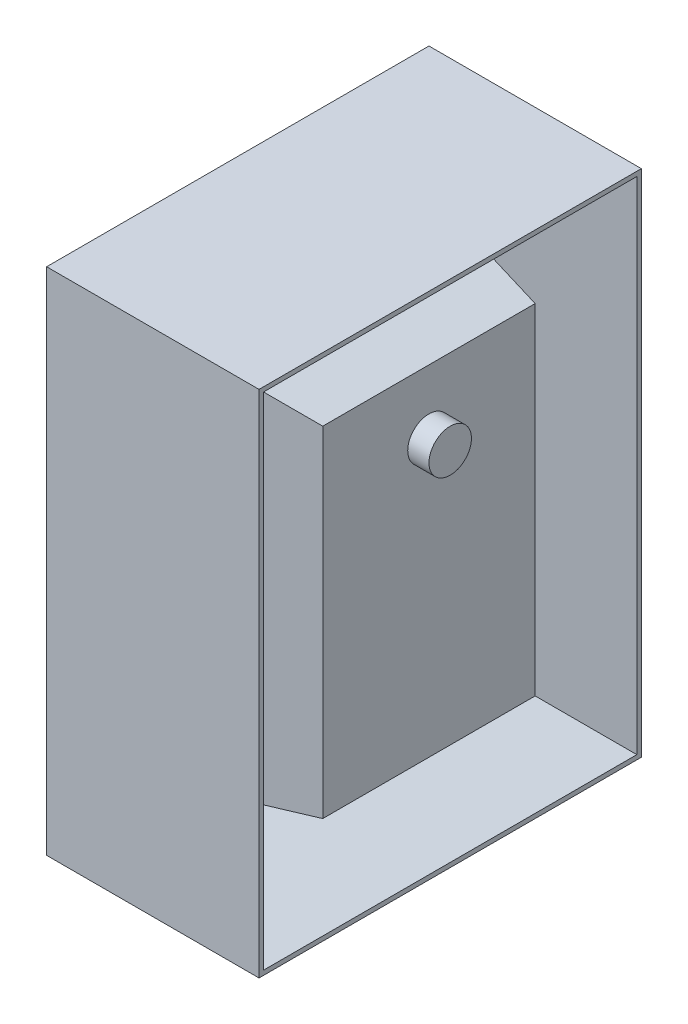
SolidWorks part; units mm, degrees
ref_plane "Plan de face" through (0, 0, 0) normal (0, 0, 1) x (1, 0, 0)
ref_plane "Plan de dessus" through (0, 0, 0) normal (0, 1, 0) x (1, 0, 0)
ref_plane "Plan de droite" through (0, 0, 0) normal (1, 0, 0) x (0, 0, -1)
sketch "Esquisse1" plane through (0, 0, 0) normal (1, 0, 0) x (0, 0, -1)
  line L1 (0, 0) -> (-90, 0)
  line L2 (0, 0) -> (0, 120)
  line L3 (0, 120) -> (-90, 120)
  line L4 (-90, 0) -> (-90, 120)
  dimension "D1" = 120
  dimension "D2" = 90
extrude "Boss.-Extru.1" add sketch "Esquisse1" along normal blind 5
sketch "Esquisse2" plane through (5, 0, 0) normal (1, 0, 0) x (0, 0, -1)
  line L1 (-90, 120) -> (0, 120)
  line L2 (-90, 120) -> (-90, 0)
  line L3 (-90, 0) -> (0, 0)
  line L4 (0, 120) -> (0, 0)
  line L5 (-81, 111) -> (-9, 111)
  line L6 (-81, 111) -> (-81, 9)
  line L7 (-81, 9) -> (-9, 9)
  line L8 (-9, 111) -> (-9, 9)
  dimension "D1" = 9
  dimension "D2" = 9
  dimension "D3" = 9
  dimension "D4" = 9
extrude "Boss.-Extru.2" add sketch "Esquisse2" along normal blind 45
sketch "Esquisse3" plane through (5, 0, 0) normal (1, 0, 0) x (0, 0, -1)
  line L0 (-81, 111) -> (-9, 9) construction
  line L2 (-70, 20) -> (-20, 20)
  line L3 (-70, 20) -> (-70, 100)
  line L4 (-70, 100) -> (-20, 100)
  line L5 (-20, 20) -> (-20, 100)
  line L6 (-70, 20) -> (-20, 100) construction
  line L7 (-70, 100) -> (-20, 20) construction
  point P4 (-45, 60)
  dimension "D1" = 50
  dimension "D2" = 80
extrude "Boss.-Extru.3" add sketch "Esquisse3" along normal blind 40
draft "Dépouille1" type of draft neutral plane draft angle 10 faces to draft 4 parameters "D1"=10
draft "Dépouille2" type of draft neutral plane draft angle 10 faces to draft 4 parameters "D1"=10
sketch "Esquisse4" plane through (45, 0, 0) normal (1, 0, 0) x (0, 0, -1)
  line L0 (-45, 100) -> (-45, 20) construction
  line L1 (-20, 100) -> (-70, 100) construction
  line L2 (-70, 20) -> (-20, 20) construction
  circle A0 centre (-45, 85) radius 5
  dimension "D1" = 10
  dimension "D2" = 15
extrude "Boss.-Extru.4" add sketch "Esquisse4" along normal blind 5
